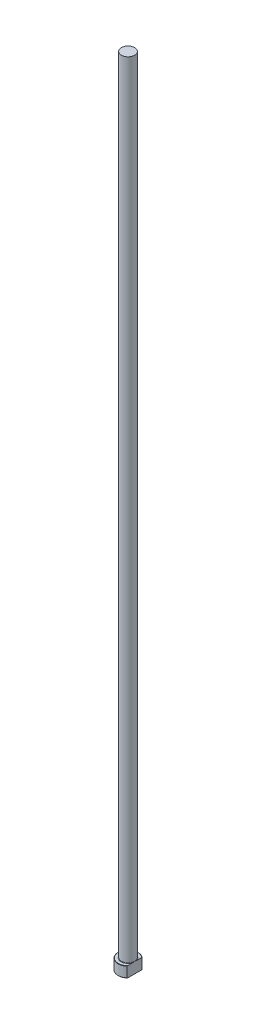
SolidWorks part; units mm, degrees
ref_plane "Front Plane" through (0, 0, 0) normal (0, 0, 1) x (1, 0, 0)
ref_plane "Top Plane" through (0, 0, 0) normal (0, 1, 0) x (1, 0, 0)
ref_plane "Right Plane" through (0, 0, 0) normal (1, 0, 0) x (0, 0, -1)
sketch "Sketch1" plane through (0, 0, 0) normal (0, 0, 1) x (1, 0, 0)
  line L0 (0, 259.9588) -> (0, -15.1925) construction
  line L1 (0, 0) -> (-7.5, 0)
  line L2 (-7.5, 0) -> (-7.5, 8)
  line L3 (-7.5, 8) -> (-5, 8)
  line L4 (-5, 8) -> (-5, 600)
  line L5 (-5, 600) -> (0, 600)
  line L6 (0, 600) -> (0, 0)
  dimension "L" = 600
  dimension "H" = 15
  dimension "T" = 8
  dimension "D" = 10
revolve "Revolve1" add sketch "Sketch1" angle 360 about L0
chamfer "Chamfer1" distance 0.2 angle 45 2 edges at (0, 8, 7.5) (0, 0, 7.5)
fillet "Fillet1" radius 0.3 1 edges at (0, 8, 5)
sketch "Sketch2" plane through (0, 0, 0) normal (0, 1, 0) x (1, 0, 0)
  line L0 (5, -5.5902) -> (5, 5.5902)
  circle A0 centre (0, 0) radius 7.5 construction
  arc A1 (5, -5.5902) -> (5, 5.5902) centre (0, 0) ccw
  circle A2 centre (0, 0) radius 5 construction
extrude "KEYED HEAD" cut sketch "Sketch2" along normal through all
